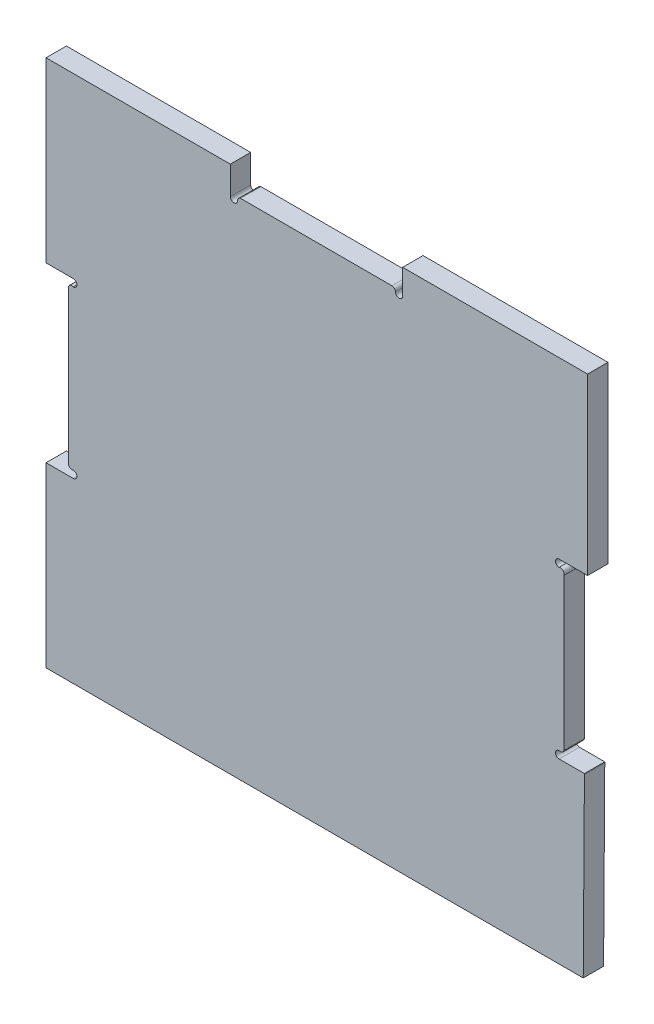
SolidWorks part; units mm, degrees
ref_plane "Front Plane" through (0, 0, 0) normal (0, 0, 1) x (1, 0, 0)
ref_plane "Top Plane" through (0, 0, 0) normal (0, 1, 0) x (1, 0, 0)
ref_plane "Right Plane" through (0, 0, 0) normal (1, 0, 0) x (0, 0, -1)
sketch "Sketch1" plane through (0, 0, 0) normal (0, 0, 1) x (1, 0, 0)
sketch_block_instance "Block1-3"
sketch_block "Block1-2" parameters "D2"=6.35, "D3"=3.9571, "D4"=3, "D8"=3, "D1"=445.1684, "D5"=22.7531, "D6"=22.7531, "D7"=155.2441, "D9"=22.7531
extrude "Boss-Extrude1" add sketch "Sketch1" along normal blind 17
